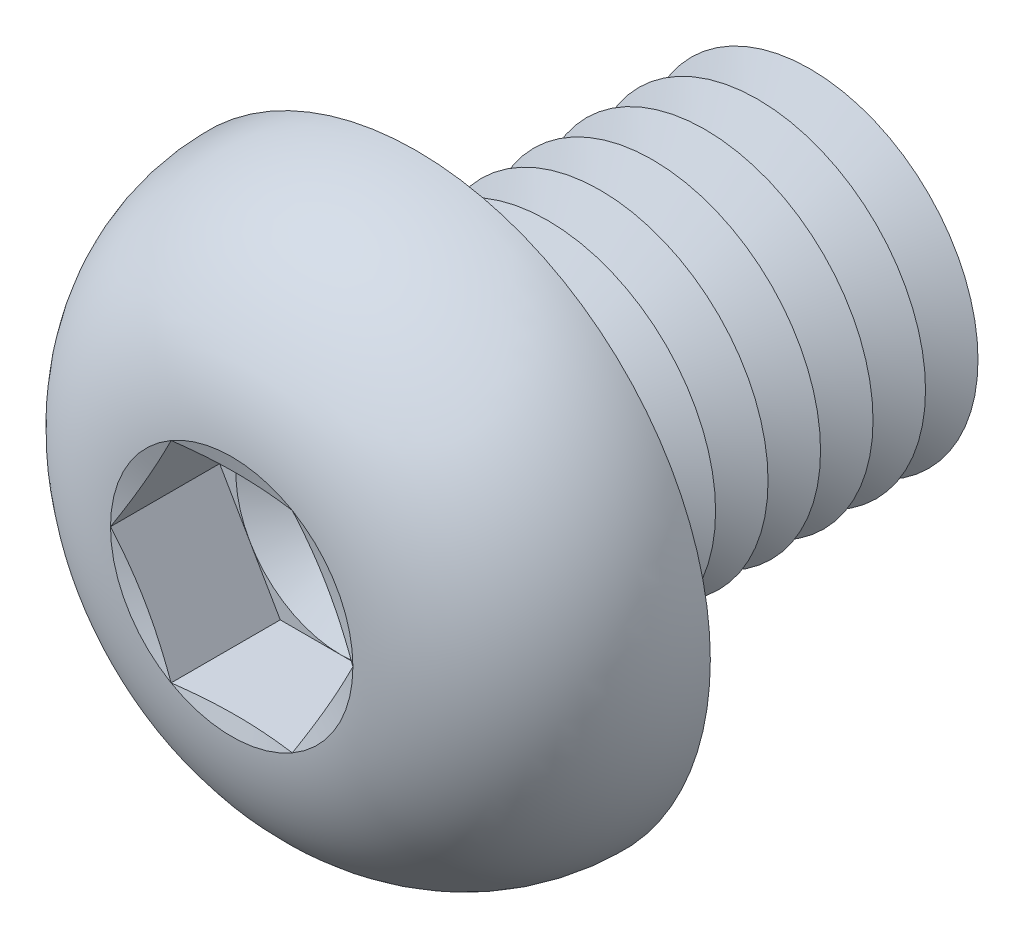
SolidWorks part; units mm, degrees
ref_plane "Front Plane" through (0, 0, 0) normal (0, 0, 1) x (1, 0, 0)
ref_plane "Top Plane" through (0, 0, 0) normal (0, 1, 0) x (1, 0, 0)
ref_plane "Right Plane" through (0, 0, 0) normal (1, 0, 0) x (0, 0, -1)
sketch "Sketch1" plane through (0, 0, 0) normal (1, 0, 0) x (0, 0, -1)
  line L0 (0, 4) -> (0, 7)
  line L3 (0, 4) -> (10, 4)
  line L4 (10, 4) -> (10, 0)
  line L5 (10, 0) -> (-4.4, 0) construction
  line L6 (-4.4, 0) -> (10, 0)
  line L7 (-4.4, 2.8867) -> (-4.4, 1.4434) construction
  line L8 (-4.4, 1.4434) -> (-4.4, 0)
  line L9 (-4.4, 2.8867) -> (-4.0132, 1.4434)
  line L10 (-4.0132, 1.4434) -> (-4.4, 1.4434)
  line L11 (10, 0) -> (22.7481, 0) construction
  line L12 (0, 7) -> (-4.4, 7) construction
  arc A1 (0, 7) -> (-4.4, 2.8867) centre (0, 2.59) ccw
  point P8 (10, 2)
  dimension "D1" = 14
  dimension "D2" = 8
  dimension "D3" = 4.4
  dimension "D4" = 5.7735
  dimension "D5" = 10
  dimension "D6" = 15
revolve "Revolve1" add sketch "Sketch1" angle 360 about L5
fillet "Fillet1" radius 0.625 1 edges at (0, 4, 0)
sketch "Sketch2" plane through (0, 0, 0) normal (1, 0, 0) x (0, 0, -1)
  line L0 (9.375, 4) -> (10.625, 4)
  line L1 (10, 4) -> (0.625, 4) construction
  line L2 (10.625, 4) -> (10, 2.9175)
  line L3 (10, -4) -> (10, 4) construction
  line L4 (10, 2.9175) -> (9.375, 4)
  dimension "D1" = 1.25
revolve "Cut-Revolve1" cut sketch "Sketch2" angle 360 about axis through (0, 0, -10) along (0, 0, -1)
pattern_linear "LPattern1" count 8 spacing 1.25 along (0, 0, 1) of "Cut-Revolve1"
sketch "Sketch3" plane through (0, 0, 4.4) normal (0, 0, 1) x (1, 0, 0)
  line L7 (1.4434, 2.5) -> (-1.4434, 2.5)
  line L8 (-1.4434, 2.5) -> (-2.8868, 0)
  line L9 (-2.8868, 0) -> (-1.4434, -2.5)
  line L10 (-1.4434, -2.5) -> (1.4434, -2.5)
  line L11 (1.4434, -2.5) -> (2.8868, 0)
  line L12 (2.8868, 0) -> (1.4434, 2.5)
  circle A0 centre (0, 0) radius 2.5 construction
  circle A3 centre (0, 0) radius 2.8868 construction
extrude "Cut-Extrude1" cut sketch "Sketch3" against normal blind 2.6
sketch "Sketch4" plane through (0, 0, 1.8) normal (0, 0, 1) x (1, 0, 0)
  line L1 (1.4434, 2.5) -> (-1.4434, 2.5) construction
  circle A0 centre (0, 0) radius 2.5
extrude "Cut-Extrude2" cut sketch "Sketch4" against normal through all draft 60
